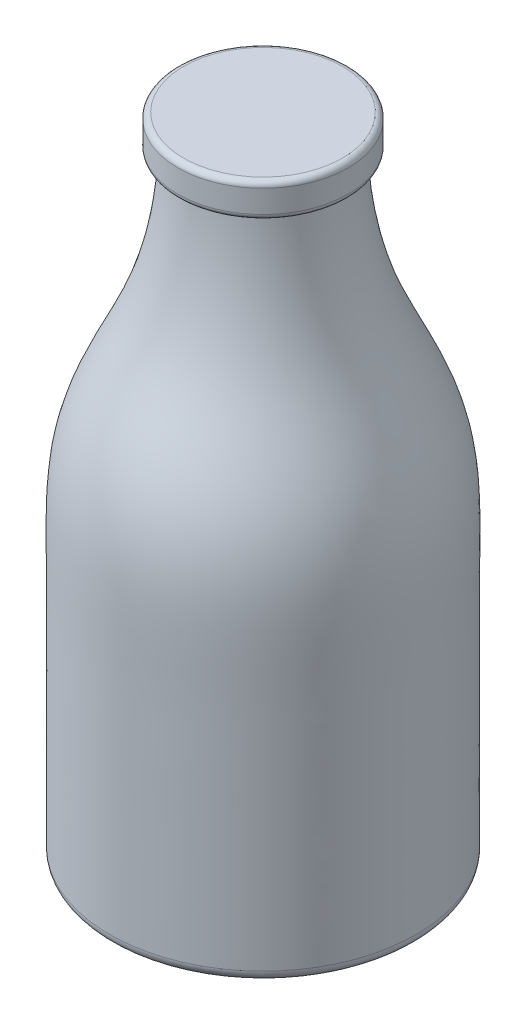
SolidWorks part; units mm, degrees
ref_plane "Front Plane" through (0, 0, 0) normal (0, 0, 1) x (1, 0, 0)
ref_plane "Top Plane" through (0, 0, 0) normal (0, 1, 0) x (1, 0, 0)
ref_plane "Right Plane" through (0, 0, 0) normal (1, 0, 0) x (0, 0, -1)
sketch "Sketch2" plane through (0, 0, 0) normal (0, 0, 1) x (1, 0, 0)
  line L0 (0, 0) -> (0, 108)
  line L2 (27, 53.8943) -> (27, 2) construction
  line L3 (25, 0) -> (0, 0)
  line L5 (13.0352, 108) -> (14, 108)
  line L6 (0, 108) -> (0, 114)
  line L7 (0, 114) -> (14, 114)
  line L8 (15, 109) -> (15, 113)
  arc A0 (13.0352, 108) -> (21.3493, 76.5512) centre (84.2359, 110) ccw construction
  arc A1 (21.3493, 76.5512) -> (27, 53.8943) centre (-21.2473, 53.8944) cw construction
  arc A2 (15, 109) -> (14, 108) centre (14, 109) cw
  arc A3 (14, 114) -> (15, 113) centre (14, 113) cw
  arc A4 (27, 2) -> (25, 0) centre (25, 2) cw
  spline S0 degree 3 poles (13.0352, 108) (13.3284, 100.1442) (15.226, 89.1047) (21.4742, 76.4119) (25.1958, 68.1484) (26.7525, 60.3833) (27.1, 52.5709) (26.9611, 43.8774) (27.0049, 35.2286) (26.9941, 21.1026) (27.0085, 10.6491) (27, 2) knots 0 0 0 0 0.21902 0.302893 0.391853 0.469303 0.52053 0.608456 0.710246 0.760265 1 1 1 1
  dimension "D1" = 1
  dimension "D2" = 2
revolve "Revolve2" add sketch "Sketch2" angle 360 about L0
